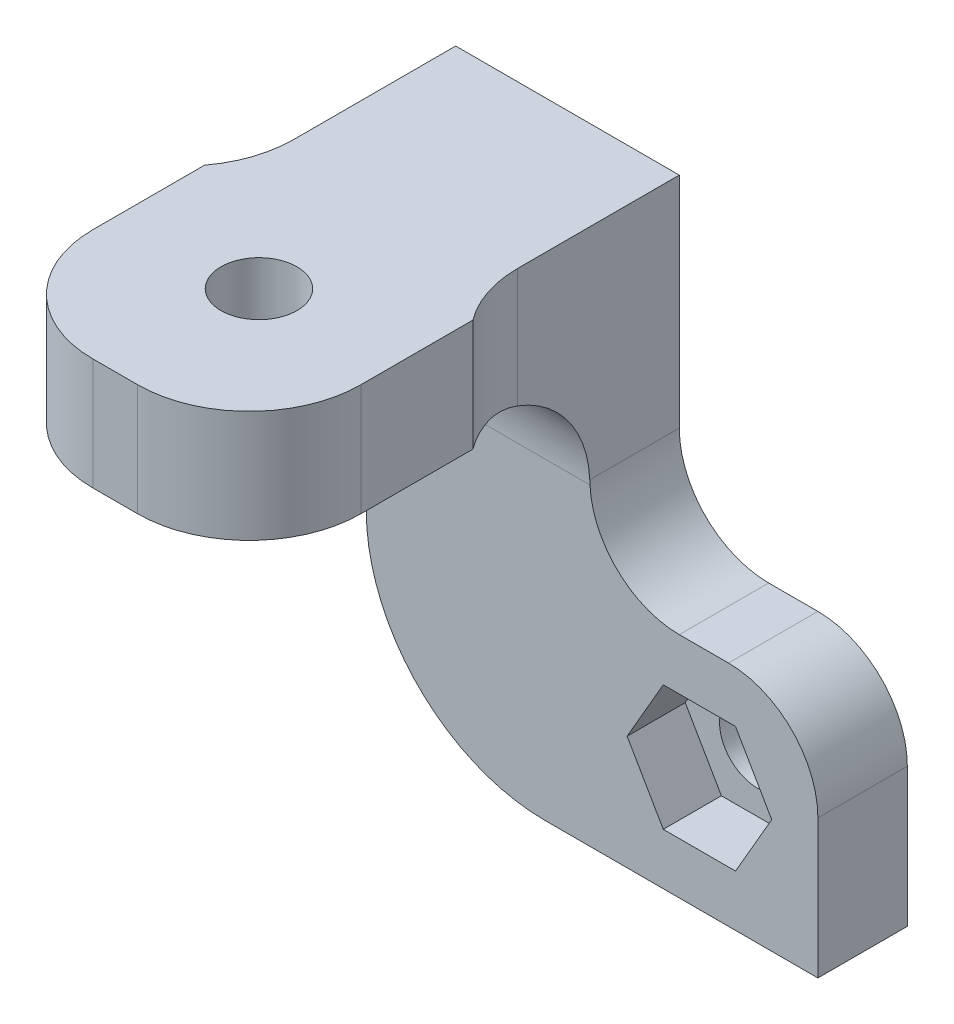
SolidWorks part; units mm, degrees
ref_plane "Front Plane" through (0, 0, 0) normal (0, 0, 1) x (1, 0, 0)
ref_plane "Top Plane" through (0, 0, 0) normal (0, 1, 0) x (1, 0, 0)
ref_plane "Right Plane" through (0, 0, 0) normal (1, 0, 0) x (0, 0, -1)
sketch "Sketch1" plane through (0, 0, 0) normal (0, 0, 1) x (1, 0, 0)
  line L1 (-11.4815, 6.2346) -> (-1.4815, 6.2346)
  line L2 (-11.4815, 6.2346) -> (-11.4815, -17.7654)
  line L3 (-11.4815, -17.7654) -> (-1.4815, -17.7654)
  line L4 (-1.4815, 6.2346) -> (-1.4815, -17.7654)
  dimension "D1" = 10
  dimension "D2" = 24
extrude "Boss-Extrude1" add sketch "Sketch1" along normal blind 4
ref_plane "Plane1" through (0, 0, 4) normal (0, 0, 1) x (1, 0, 0)
sketch "Sketch2" plane through (0, 0, 4) normal (0, 0, 1) x (1, 0, 0)
  line L0 (-11.4815, 6.2346) -> (-11.4815, -17.7654) construction
  line L1 (-11.4815, 1.2346) -> (-1.4815, 1.2346)
  line L2 (-11.4815, 1.2346) -> (-11.4815, 6.2346)
  line L3 (-11.4815, 6.2346) -> (-1.4815, 6.2346)
  line L4 (-1.4815, 1.2346) -> (-1.4815, 6.2346)
  dimension "D1" = 5
extrude "Boss-Extrude2" add sketch "Sketch2" along normal blind 15.4
ref_plane "Plane2" through (0, 1.2346, 0) normal (0, -1, 0) x (-1, 0, 0)
sketch "Sketch4" plane through (0, 1.2346, 0) normal (0, -1, 0) x (-1, 0, 0)
  line L1 (6.4815, -10.5668) -> (3.6815, -12.1834)
  line L2 (3.6815, -12.1834) -> (3.6815, -15.4166)
  line L3 (3.6815, -15.4166) -> (6.4815, -17.0332)
  line L4 (6.4815, -17.0332) -> (9.2815, -15.4166)
  line L5 (9.2815, -15.4166) -> (9.2815, -12.1834)
  line L6 (9.2815, -12.1834) -> (6.4815, -10.5668)
  circle A0 centre (6.4815, -13.8) radius 2.8 construction
  dimension "D1" = 5.6
extrude "Cut-Extrude1" cut sketch "Sketch4" against normal blind 2.6
sketch "Sketch5" plane through (0, 1.2346, 0) normal (0, -1, 0) x (-1, 0, 0)
  circle A0 centre (6.4815, -13.8) radius 1.7
extrude "Cut-Extrude2" cut sketch "Sketch5" against normal blind 8.6
fillet "Fillet1" radius 5 1 edges at (-6.4815, 1.2346, 4)
sketch "Sketch6" plane through (0, 0, 0) normal (0, 0, 1) x (1, 0, 0)
  line L0 (-1.4815, -17.7654) -> (-1.4815, -3.7654) construction
  line L1 (8.7185, -17.7654) -> (-1.4815, -17.7654)
  line L2 (8.7185, -17.7654) -> (8.7185, -7.5654)
  line L3 (8.7185, -7.5654) -> (-1.4815, -7.5654)
  line L4 (-1.4815, -17.7654) -> (-1.4815, -7.5654)
  circle A0 centre (3.4185, -12.6654) radius 1.7
  dimension "D3" = 3.4
  dimension "D1" = 10.2
  dimension "D2" = 10.2
  dimension "D4" = 5.1
  dimension "D5" = 5.3
extrude "Boss-Extrude3" add sketch "Sketch6" along normal blind 4
sketch "Sketch7" plane through (0, 0, 4) normal (0, 0, 1) x (1, 0, 0)
  line L1 (5.0351, -9.8654) -> (1.8019, -9.8654)
  line L2 (1.8019, -9.8654) -> (0.1854, -12.6654)
  line L3 (0.1854, -12.6654) -> (1.8019, -15.4654)
  line L4 (1.8019, -15.4654) -> (5.0351, -15.4654)
  line L5 (5.0351, -15.4654) -> (6.6517, -12.6654)
  line L6 (6.6517, -12.6654) -> (5.0351, -9.8654)
  circle A0 centre (3.4185, -12.6654) radius 2.8 construction
  dimension "D1" = 5.6
extrude "Cut-Extrude3" cut sketch "Sketch7" against normal blind 2.6
fillet "Fillet2" radius 4 2 edges at (8.7185, -7.5654, 2) (-1.4815, -7.5654, 2)
fillet "Fillet3" radius 8 1 edges at (-11.4815, -17.7654, 2)
sketch "Sketch8" plane through (0, 1.2346, 0) normal (0, -1, 0) x (-1, 0, 0)
  line L0 (12.4815, -20.2332) -> (0.4815, -20.2332)
  line L1 (3.6815, -12.1834) -> (3.6815, -15.4166) construction
  line L2 (1.4815, -19.4) -> (1.4815, -10.2332)
  line L3 (1.4815, -10.2332) -> (0.4815, -10.2332)
  line L4 (0.4815, -20.2332) -> (0.4815, -10.2332)
  line L5 (9.2815, -15.4166) -> (9.2815, -12.1834) construction
  line L6 (11.4815, -19.4) -> (11.4815, -10.2332)
  line L7 (11.4815, -10.2332) -> (12.4815, -10.2332)
  line L8 (12.4815, -20.2332) -> (12.4815, -10.2332)
  line L13 (11.4815, -19.4) -> (11.4815, -9)
  line L14 (11.4815, -9) -> (1.4815, -9)
  line L15 (1.4815, -9) -> (1.4815, -19.4)
  line L16 (1.4815, -19.4) -> (11.4815, -19.4)
  line L20 (1.4815, -19.4) -> (11.4815, -19.4)
  point P16 (3.6815, -13.8)
  dimension "D1" = 3.2
  dimension "D2" = 3.2
  dimension "D3" = 3.2
  dimension "D4" = 10
  dimension "D5" = 10
  dimension "D6" = 0
extrude "Boss-Extrude4" add sketch "Sketch8" against normal blind 5
fillet "Fillet5" radius 5 4 edges at (-11.4815, 3.7346, 10.2332) (-1.4815, 3.7346, 10.2332) (-0.4815, 3.7346, 20.2332) (-12.4815, 3.7346, 20.2332)
